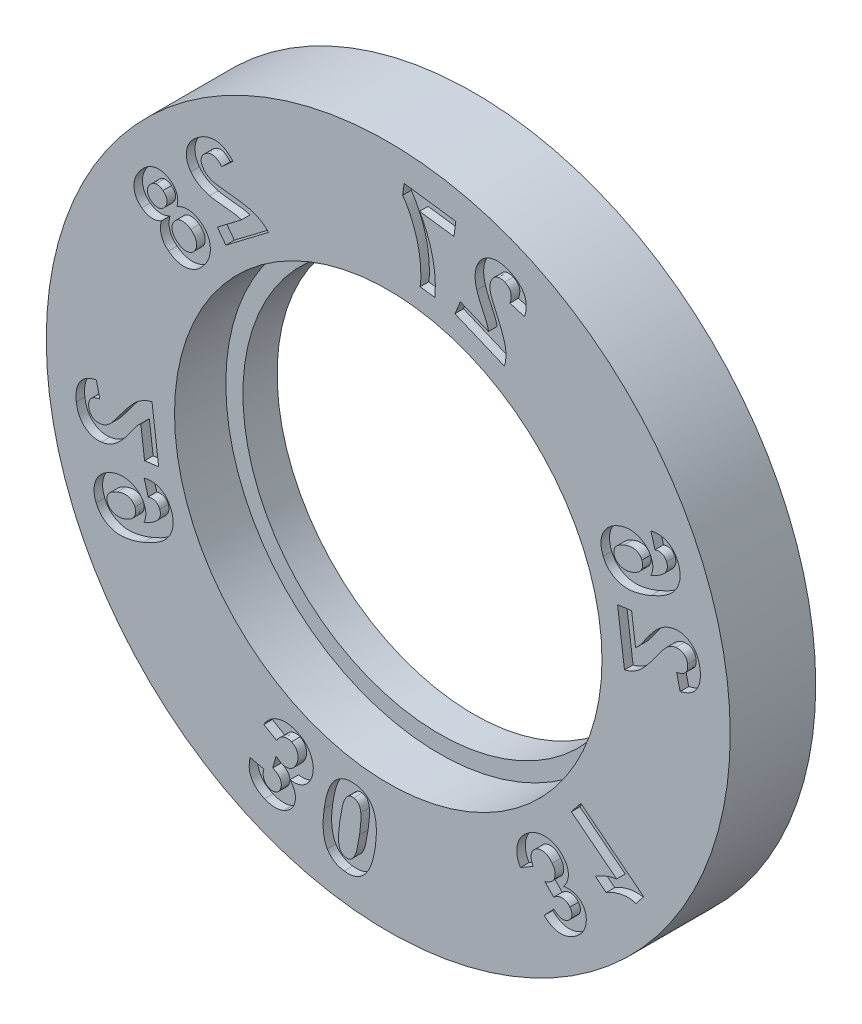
SolidWorks part; units mm, degrees
ref_plane "Front Plane" through (0, 0, 0) normal (0, 0, 1) x (1, 0, 0)
ref_plane "Top Plane" through (0, 0, 0) normal (0, 1, 0) x (1, 0, 0)
ref_plane "Right Plane" through (0, 0, 0) normal (1, 0, 0) x (0, 0, -1)
imported_body "Imported1"
other "DeleteFace2"
sketch "Sketch2" plane through (0, 0, 0) normal (0, 0, 1) x (1, 0, 0)
  line L2 (0, 0) -> (0, 21.375) construction
  line L3 (0, 0) -> (18.5113, 10.6875) construction
  line L4 (0, 0) -> (18.5113, -10.6875) construction
  line L5 (0, 0) -> (0, -21.375) construction
  line L6 (0, 0) -> (-18.5113, -10.6875) construction
  line L7 (0, 0) -> (-18.5113, 10.6875) construction
  circle A0 centre (0, 0) radius 13.8372 construction
  text T0 "26    27    28    29    30    31" font "Arial" height 4.7
  point P11 (0, 0)
  dimension "D1" = 6
extrude "Cut-Extrude1" cut sketch "Sketch2" against normal blind 0.5
